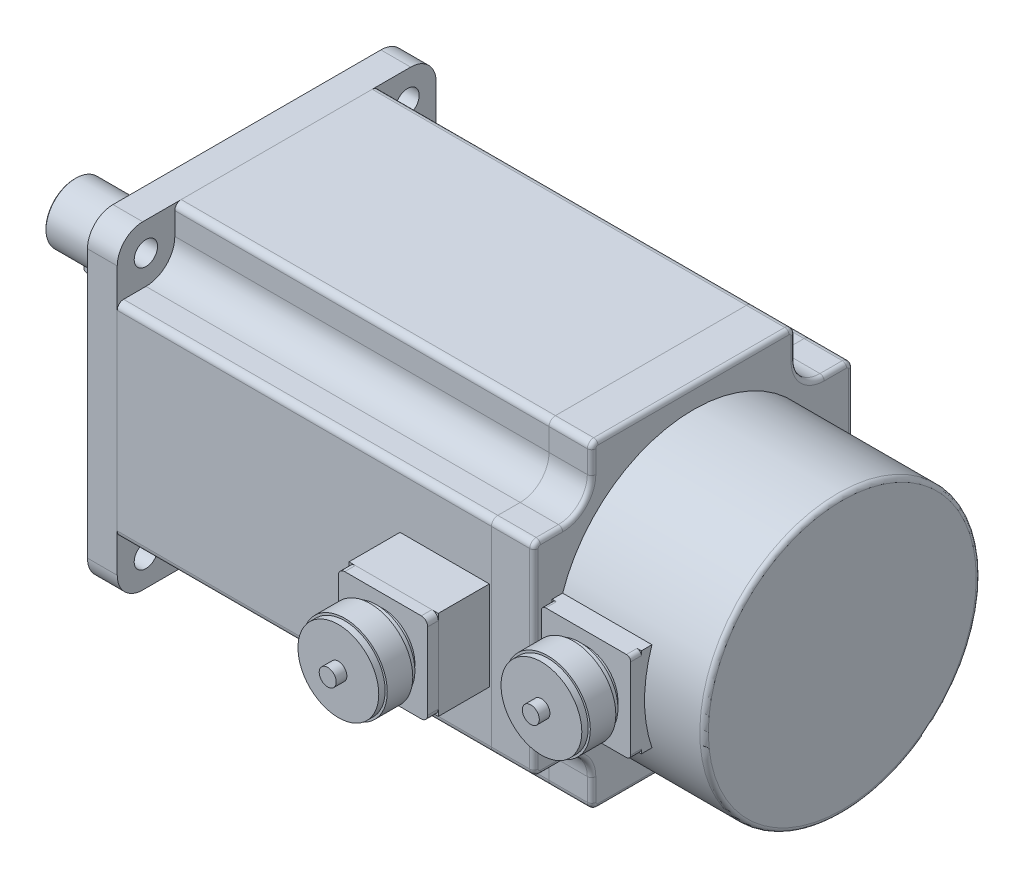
SolidWorks part; units mm, degrees
ref_plane "前视基准面" through (0, 0, 0) normal (0, 0, 1) x (1, 0, 0)
ref_plane "上视基准面" through (0, 0, 0) normal (0, 1, 0) x (1, 0, 0)
ref_plane "右视基准面" through (0, 0, 0) normal (1, 0, 0) x (0, 0, -1)
sketch "草图1" plane through (0, 0, 0) normal (1, 0, 0) x (0, 0, -1)
  line L1 (-63, -75) -> (63, -75)
  line L2 (-75, -63) -> (-75, 63)
  line L3 (-63, 75) -> (63, 75)
  line L4 (75, -63) -> (75, 63)
  line L5 (-75, -75) -> (75, 75) construction
  line L6 (-75, 75) -> (75, -75) construction
  arc A0 (63, -75) -> (75, -63) centre (63, -63) ccw
  arc A1 (-63, -75) -> (-75, -63) centre (-63, -63) cw
  arc A2 (-75, 63) -> (-63, 75) centre (-63, 63) cw
  arc A3 (63, 75) -> (75, 63) centre (63, 63) cw
  point P0 (0, 0)
  dimension "D1" = 12
extrude "凸台-拉伸1" add sketch "草图1" along normal blind 20
sketch "草图2" plane through (0, 0, 0) normal (-1, 0, 0) x (0, 0, 1)
  line L0 (-63, 75) -> (63, 75) construction
  line L1 (-63, -75) -> (63, -75)
  line L2 (-75, -63) -> (-75, 63)
  line L3 (-63, 75) -> (63, 75)
  line L4 (75, -63) -> (75, 63)
  line L5 (-75, -75) -> (75, 75) construction
  line L6 (-75, 75) -> (75, -75) construction
  arc A0 (63, 75) -> (75, 63) centre (63, 63) cw
  arc A1 (63, -75) -> (75, -63) centre (63, -63) ccw
  arc A2 (-63, -75) -> (-75, -63) centre (-63, -63) cw
  arc A3 (-75, 63) -> (-63, 75) centre (-63, 63) cw
  point P0 (0, 0)
  dimension "D1" = 12
extrude "凸台-拉伸2" add sketch "草图2" along normal blind 176 separate body
sketch "草图3" plane through (-176, 0, 0) normal (-1, 0, 0) x (0, 0, 1)
  line L0 (63, 75) -> (-63, 75) construction
  line L1 (-63, -75) -> (63, -75)
  line L2 (-75, -63) -> (-75, 63)
  line L3 (-63, 75) -> (63, 75)
  line L4 (75, -63) -> (75, 63)
  line L5 (-75, -75) -> (75, 75) construction
  line L6 (-75, 75) -> (75, -75) construction
  arc A0 (-63, -75) -> (-75, -63) centre (-63, -63) cw
  arc A1 (63, -75) -> (75, -63) centre (63, -63) ccw
  arc A2 (63, 75) -> (75, 63) centre (63, 63) cw
  arc A3 (-75, 63) -> (-63, 75) centre (-63, 63) cw
  point P0 (0, 0)
  dimension "D1" = 12
extrude "凸台-拉伸3" add sketch "草图3" along normal blind 14 separate body
sketch "草图4" plane through (0, 0, 75) normal (0, 0, 1) x (1, 0, 0)
  line L2 (-43, -21) -> (-1, -21)
  line L3 (-43, -21) -> (-43, 21)
  line L4 (-43, 21) -> (-1, 21)
  line L5 (-1, -21) -> (-1, 21)
  line L6 (-43, -21) -> (-1, 21) construction
  line L7 (-43, 21) -> (-1, -21) construction
extrude "凸台-拉伸4" add sketch "草图4" along normal blind 24 separate body
sketch "草图5" plane through (0, 0, 99) normal (0, 0, 1) x (1, 0, 0)
  line L0 (-1, 21) -> (-43, 21) construction
  line L1 (-40, -21) -> (-4, -21)
  line L2 (-43, -18) -> (-43, 18)
  line L3 (-40, 21) -> (-4, 21)
  line L4 (-1, -18) -> (-1, 18)
  line L5 (-43, -21) -> (-1, 21) construction
  line L6 (-43, 21) -> (-1, -21) construction
  arc A0 (-40, -21) -> (-43, -18) centre (-40, -18) cw
  arc A1 (-4, -21) -> (-1, -18) centre (-4, -18) ccw
  arc A2 (-4, 21) -> (-1, 18) centre (-4, 18) cw
  arc A3 (-43, 18) -> (-40, 21) centre (-40, 18) cw
  point P0 (-22, 0)
  dimension "D1" = 3
extrude "凸台-拉伸5" add sketch "草图5" along normal blind 5 separate body
sketch "草图6" plane through (0, 0, 104) normal (0, 0, 1) x (1, 0, 0)
  circle A0 centre (-22, 0) radius 15
extrude "凸台-拉伸6" add sketch "草图6" along normal blind 3 separate body
sketch "草图7" plane through (0, 0, 107) normal (0, 0, 1) x (1, 0, 0)
  circle A0 centre (-22, 0) radius 18
extrude "凸台-拉伸7" add sketch "草图7" along normal blind 3 separate body
sketch "草图8" plane through (0, 0, 110) normal (0, 0, 1) x (1, 0, 0)
  circle A0 centre (-22, 0) radius 20
extrude "凸台-拉伸8" add sketch "草图8" along normal blind 12 separate body
sketch "草图9" plane through (0, 0, 122) normal (0, 0, 1) x (1, 0, 0)
  circle A0 centre (-22, 0) radius 19
extrude "凸台-拉伸9" add sketch "草图9" along normal blind 3
sketch "草图10" plane through (0, 0, 125) normal (0, 0, 1) x (1, 0, 0)
  circle A0 centre (-22, 0) radius 4
extrude "凸台-拉伸10" add sketch "草图10" along normal blind 5
sketch "草图11" plane through (20, 0, 0) normal (1, 0, 0) x (0, 0, -1)
  line L0 (47.9169, -61.5) -> (47.9169, -72)
  line L1 (-75, -44.9169) -> (-75, -63)
  line L2 (-63, -75) -> (-44.9169, -75)
  line L3 (44.9169, -75) -> (63, -75)
  line L4 (75, -63) -> (75, -44.9169)
  line L6 (75, 63) -> (75, 44.9169)
  line L7 (-63, -75) -> (63, -75) construction
  line L8 (63, 75) -> (44.9169, 75)
  line L9 (-47.9169, -72) -> (-47.9169, -61.5)
  line L10 (-44.9169, 75) -> (-63, 75)
  line L11 (-61.5, -47.9169) -> (-72, -47.9169)
  line L12 (75, -63) -> (75, 63) construction
  line L13 (-75, 63) -> (-75, 44.9169)
  line L14 (-72, 47.9169) -> (-61.5, 47.9169)
  line L16 (-47.9169, 61.5) -> (-47.9169, 72)
  line L17 (63, 75) -> (-63, 75) construction
  line L19 (47.9169, 72) -> (47.9169, 61.5)
  line L21 (61.5, 47.9169) -> (72, 47.9169)
  line L22 (-75, 63) -> (-75, -63) construction
  line L24 (72, -47.9169) -> (61.5, -47.9169)
  arc A0 (-61.5, 47.9169) -> (-47.9169, 61.5) centre (-61.5, 61.5) ccw
  arc A1 (47.9169, 61.5) -> (61.5, 47.9169) centre (61.5, 61.5) ccw
  arc A2 (-47.9169, -61.5) -> (-61.5, -47.9169) centre (-61.5, -61.5) ccw
  arc A3 (-72, -47.9169) -> (-75, -44.9169) centre (-72, -44.9169) cw
  arc A4 (61.5, -47.9169) -> (47.9169, -61.5) centre (61.5, -61.5) ccw
  arc A5 (-75, 44.9169) -> (-72, 47.9169) centre (-72, 44.9169) cw
  arc A6 (-47.9169, 72) -> (-44.9169, 75) centre (-44.9169, 72) cw
  arc A7 (44.9169, 75) -> (47.9169, 72) centre (44.9169, 72) cw
  arc A8 (72, 47.9169) -> (75, 44.9169) centre (72, 44.9169) cw
  arc A9 (75, -44.9169) -> (72, -47.9169) centre (72, -44.9169) cw
  arc A10 (47.9169, -72) -> (44.9169, -75) centre (44.9169, -72) cw
  arc A11 (-44.9169, -75) -> (-47.9169, -72) centre (-44.9169, -72) cw
  arc A12 (-63, 75) -> (-75, 63) centre (-63, 63) ccw
  arc A13 (75, 63) -> (63, 75) centre (63, 63) ccw
  arc A14 (63, -75) -> (75, -63) centre (63, -63) ccw
  arc A15 (-75, -63) -> (-63, -75) centre (-63, -63) ccw
  point P0 (0, 0)
  point P1 (0, 0)
  point P12 (-75, -47.9169)
  point P43 (-75, 47.9169)
  point P47 (-47.9169, 75)
  point P48 (51.9891, -75)
  point P52 (47.9169, 75)
  point P56 (75, 47.9169)
  point P65 (75, -47.9169)
  point P82 (-47.9169, -75)
  dimension "D1" = 3
extrude "切除-拉伸2" cut sketch "草图11" against normal blind 196
fillet "圆角1" radius 2 24 edges at (20, 75, 0) (20, 0, -75) (20, -75, 0) (20, 0, 75) (20, 47.0382, 74.1213) (20, 47.9169, 66.75) (20, 51.8953, 51.8953) (20, 66.75, 47.9169) (20, 74.1213, 47.0382) (20, 74.1213, -47.0382) (20, 66.75, -47.9169) (20, 51.8953, -51.8953) (20, 47.9169, -66.75) (20, 47.0382, -74.1213) (20, -47.0382, -74.1213) (20, -47.9169, -66.75) (20, -51.8953, -51.8953) (20, -66.75, -47.9169) (20, -74.1213, -47.0382) (20, -74.1213, 47.0382) (20, -66.75, 47.9169) (20, -51.8953, 51.8953) (20, -47.9169, 66.75) (20, -47.0382, 74.1213)
sketch "草图12" plane through (-190, 0, 0) normal (-1, 0, 0) x (0, 0, 1)
  circle A2 centre (-61.5183, 61.5183) radius 5.5
  circle A3 centre (61.5183, 61.5183) radius 5.5
  circle A4 centre (-61.5183, -61.5183) radius 5.5
  circle A5 centre (61.5183, -61.5183) radius 5.5
extrude "切除-拉伸3" cut sketch "草图12" against normal blind 14
sketch "草图13" plane through (-190, 0, 0) normal (-1, 0, 0) x (0, 0, 1)
  circle A0 centre (0, 0) radius 65
  circle A1 centre (0, 0) radius 57.5
extrude "凸台-拉伸11" add sketch "草图13" along normal blind 6 separate body
sketch "草图14" plane through (-190, 0, 0) normal (-1, 0, 0) x (0, 0, 1)
  circle A0 centre (0, 0) radius 35
extrude "凸台-拉伸12" add sketch "草图14" along normal blind 6
sketch "草图15" plane through (-196, 0, 0) normal (-1, 0, 0) x (0, 0, 1)
  circle A0 centre (0, 0) radius 17.5
extrude "凸台-拉伸13" add sketch "草图15" along normal blind 3 separate body
fillet "圆角2" radius 0.5 1 edges at (-199, 0, 17.5)
sketch "草图16" plane through (-199, 0, 0) normal (-1, 0, 0) x (0, 0, 1)
  circle A0 centre (0, 0) radius 14
extrude "凸台-拉伸14" add sketch "草图16" along normal blind 72
chamfer "倒角1" distance 0.5 angle 45 1 edges at (-271, 0, 14)
ref_plane "基准面1" through (0, -14, 0) normal (0, 1, 0) x (1, 0, 0)
sketch "草图19" plane through (20, 0, 0) normal (1, 0, 0) x (0, 0, -1)
  circle A0 centre (0, 0) radius 65
extrude "凸台-拉伸16" add sketch "草图19" along normal blind 70 separate body
fillet "圆角3" radius 2 1 edges at (90, 0, -65)
ref_plane "基准面2" through (0, 0, 65) normal (0, 0, 1) x (1, 0, 0)
sketch "草图20" plane through (0, 0, 65) normal (0, 0, 1) x (1, 0, 0)
  line L1 (20, 65) -> (20, -65) construction
  line L3 (62, -21) -> (20, -21)
  line L4 (62, -21) -> (62, 21)
  line L5 (62, 21) -> (20, 21)
  line L6 (20, -21) -> (20, 21)
  line L7 (62, -21) -> (20, 21) construction
  line L8 (62, 21) -> (20, -21) construction
extrude "切除-拉伸5" cut sketch "草图20" against normal blind 10
sketch "草图21" plane through (0, 0, 55) normal (0, 0, 1) x (1, 0, 0)
  line L0 (62, 21) -> (20, 21) construction
  line L1 (20, -21) -> (62, -21)
  line L2 (20, -21) -> (20, 21)
  line L3 (20, 21) -> (62, 21)
  line L4 (62, -21) -> (62, 21)
  line L5 (20, -21) -> (62, 21) construction
  line L6 (20, 21) -> (62, -21) construction
  line L7 (20, 21) -> (62, 21) construction
  point P0 (41, 0)
extrude "凸台-拉伸17" add sketch "草图21" along normal blind 11.5
sketch "草图22" plane through (0, 0, 66.5) normal (0, 0, 1) x (1, 0, 0)
  line L0 (62, -21) -> (62, 21) construction
  line L1 (22, -21) -> (60, -21)
  line L2 (20, -19) -> (20, 19)
  line L3 (22, 21) -> (60, 21)
  line L4 (62, -19) -> (62, 19)
  line L5 (20, -21) -> (62, 21) construction
  line L6 (20, 21) -> (62, -21) construction
  line L7 (20, 21) -> (62, 21) construction
  arc A0 (22, -21) -> (20, -19) centre (22, -19) cw
  arc A1 (60, -21) -> (62, -19) centre (60, -19) ccw
  arc A2 (60, 21) -> (62, 19) centre (60, 19) cw
  arc A3 (20, 19) -> (22, 21) centre (22, 19) cw
  point P0 (41, 0)
  dimension "D1" = 2
extrude "凸台-拉伸18" add sketch "草图22" along normal blind 5 separate body
sketch "草图23" plane through (0, 0, 71.5) normal (0, 0, 1) x (1, 0, 0)
  circle A0 centre (41, 0) radius 15
extrude "凸台-拉伸19" add sketch "草图23" along normal blind 3
sketch "草图24" plane through (0, 0, 74.5) normal (0, 0, 1) x (1, 0, 0)
  circle A0 centre (41, 0) radius 18
extrude "凸台-拉伸20" add sketch "草图24" along normal blind 3
sketch "草图25" plane through (0, 0, 77.5) normal (0, 0, 1) x (1, 0, 0)
  circle A0 centre (41, 0) radius 20
extrude "凸台-拉伸21" add sketch "草图25" along normal blind 12
sketch "草图26" plane through (0, 0, 89.5) normal (0, 0, 1) x (1, 0, 0)
  circle A0 centre (41, 0) radius 19
extrude "凸台-拉伸22" add sketch "草图26" along normal blind 3
sketch "草图27" plane through (0, 0, 92.5) normal (0, 0, 1) x (1, 0, 0)
  circle A0 centre (41, 0) radius 4
extrude "凸台-拉伸23" add sketch "草图27" along normal blind 5
sketch "草图29" plane through (0, -14, 0) normal (0, 1, 0) x (1, 0, 0)
  line L4 (-261, -4) -> (-214, -4)
  line L6 (-214, 4) -> (-261, 4)
  arc A0 (-261, 4) -> (-261, -4) centre (-261, 0) ccw
  arc A1 (-214, -4) -> (-214, 4) centre (-214, 0) ccw
extrude "切除-拉伸6" cut sketch "草图29" along normal blind 4
sketch "草图30" plane through (0, -10, 0) normal (0, -1, 0) x (1, 0, 0)
  line L0 (-261, 4) -> (-214, 4)
  line L2 (-214, -4) -> (-261, -4)
  arc A0 (-261, 4) -> (-261, -4) centre (-261, 0) ccw
  arc A1 (-214, -4) -> (-214, 4) centre (-214, 0) ccw
extrude "凸台-拉伸24" add sketch "草图30" along normal blind 8 separate body
